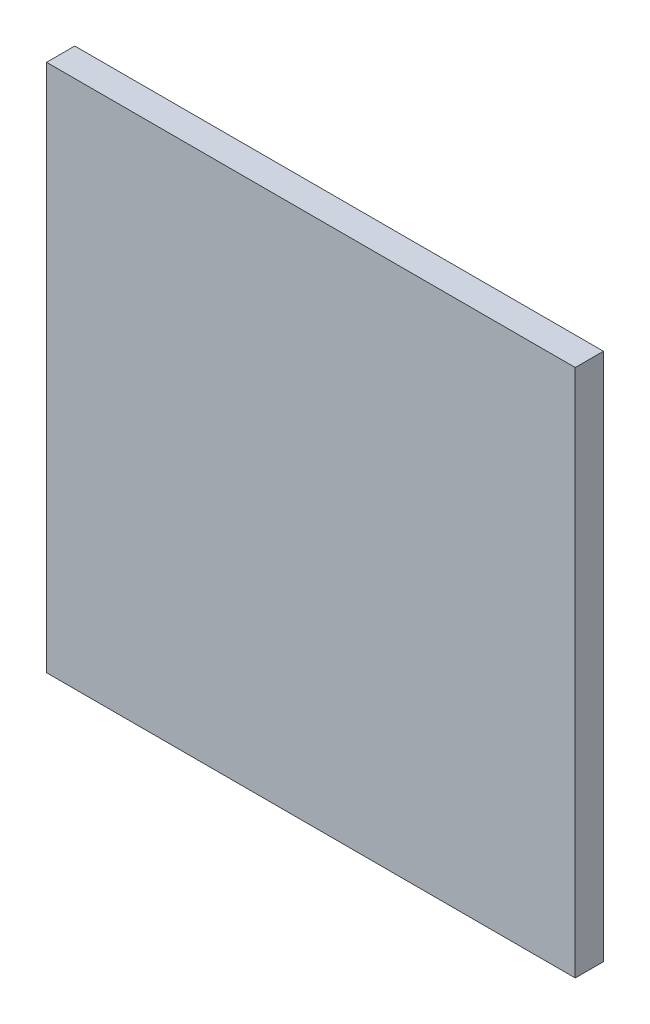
SolidWorks part; units mm, degrees
ref_plane "前视基准面" through (0, 0, 0) normal (0, 0, 1) x (1, 0, 0)
ref_plane "上视基准面" through (0, 0, 0) normal (0, 1, 0) x (1, 0, 0)
ref_plane "右视基准面" through (0, 0, 0) normal (1, 0, 0) x (0, 0, -1)
sketch "草图1" plane through (0, 0, 0) normal (0, 0, 1) x (1, 0, 0)
  line L1 (-75, 75) -> (75, 75)
  line L2 (-75, 75) -> (-75, -75)
  line L3 (-75, -75) -> (75, -75)
  line L4 (75, 75) -> (75, -75)
  dimension "D1" = 150
  dimension "D2" = 150
  dimension "D3" = 75
  dimension "D4" = 75
extrude "拉伸1" add sketch "草图1" along normal blind 8
